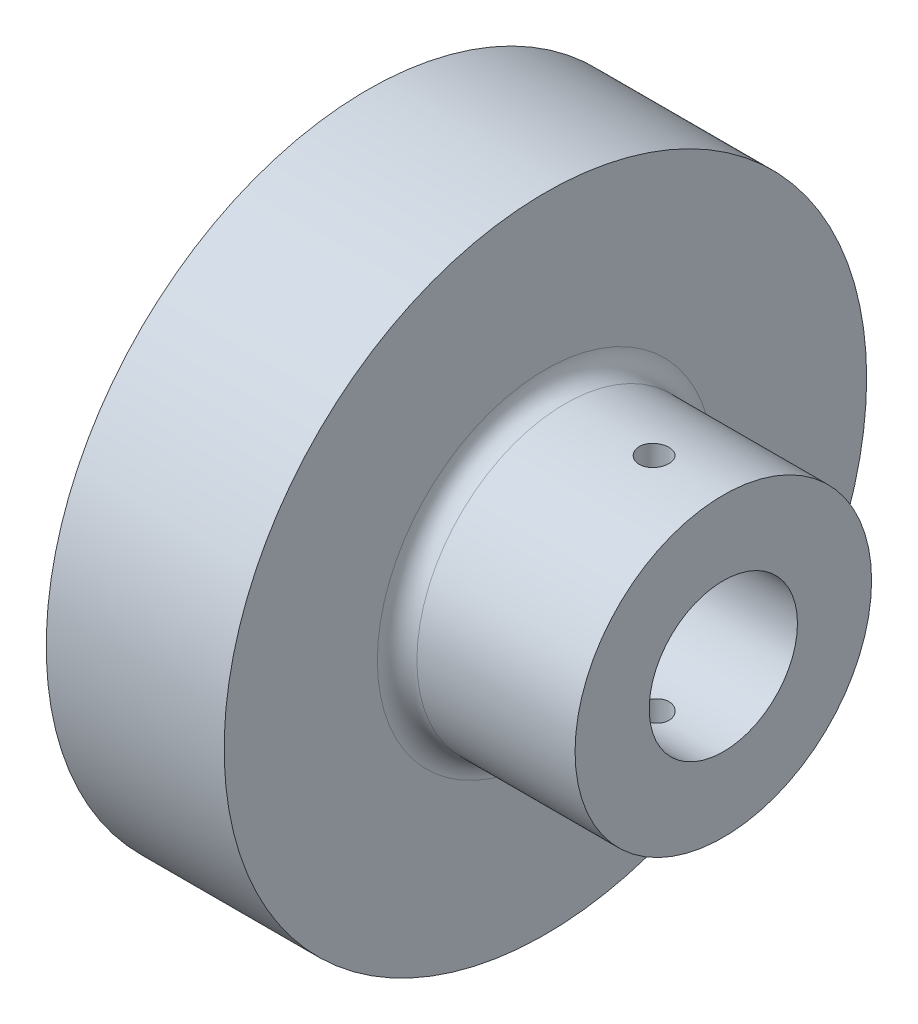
SolidWorks part; units mm, degrees
ref_plane "Front Plane" through (0, 0, 0) normal (0, 0, 1) x (1, 0, 0)
ref_plane "Top Plane" through (0, 0, 0) normal (0, 1, 0) x (1, 0, 0)
ref_plane "Right Plane" through (0, 0, 0) normal (1, 0, 0) x (0, 0, -1)
sketch "Sketch1" plane through (0, 0, 0) normal (0, 0, 1) x (1, 0, 0)
  line L0 (74.9238, 0) -> (-61.1944, 0) construction
  line L1 (38.366, 7.5) -> (10.366, 7.5)
  line L2 (10.366, 7.5) -> (10.366, 27)
  line L3 (10.366, 27) -> (2.366, 27)
  line L4 (2.366, 27) -> (2.366, 32.5)
  line L5 (2.366, 32.5) -> (20.366, 32.5)
  line L6 (20.366, 32.5) -> (20.366, 15)
  line L7 (20.366, 15) -> (38.366, 15)
  line L8 (38.366, 15) -> (38.366, 7.5)
  dimension "D1" = 36
  dimension "D2" = 18
  dimension "D3" = 8
  dimension "D4" = 32.5
  dimension "D5" = 27
  dimension "D6" = 15
  dimension "D7" = 7.5
revolve "Revolve1" add sketch "Sketch1" angle 360 about L0
sketch "Sketch4" plane through (0, 0, 0) normal (0, 1, 0) x (1, 0, 0)
  line L0 (38.366, 5.4178) -> (38.366, 0) construction
  line L1 (38.366, -15) -> (38.366, 15) construction
  circle A0 centre (31.366, 0) radius 1.5
  dimension "D1" = 3
  dimension "D2" = 7
extrude "Cut-Extrude1" cut sketch "Sketch4" against normal blind 47 and the other way blind 49
fillet "Fillet1" radius 2 2 edges at (20.366, 0, -15) (10.366, 0, -27)
